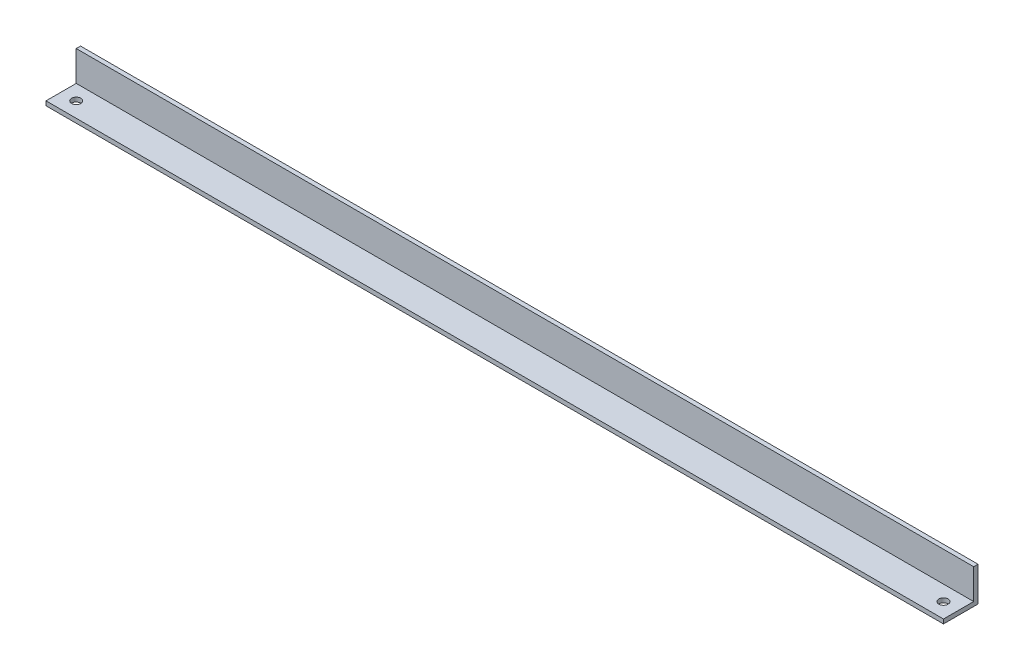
SolidWorks part; units mm, degrees
ref_plane "Front Plane" through (0, 0, 0) normal (0, 0, 1) x (1, 0, 0)
ref_plane "Top Plane" through (0, 0, 0) normal (0, 1, 0) x (1, 0, 0)
ref_plane "Right Plane" through (0, 0, 0) normal (1, 0, 0) x (0, 0, -1)
sketch "Sketch1" plane through (0, 0, 0) normal (0, 1, 0) x (1, 0, 0)
  line L1 (-330.2, 12.7) -> (330.2, 12.7)
  line L2 (-330.2, 12.7) -> (-330.2, -12.7)
  line L3 (-330.2, -12.7) -> (330.2, -12.7)
  line L4 (330.2, 12.7) -> (330.2, -12.7)
  line L5 (-330.2, 12.7) -> (330.2, -12.7) construction
  line L6 (-330.2, -12.7) -> (330.2, 12.7) construction
  point P0 (0, 0)
  dimension "D1" = 660.4
  dimension "D2" = 25.4
extrude "Boss-Extrude1" add sketch "Sketch1" along normal blind 3.175
sketch "Sketch2" plane through (0, 3.175, 0) normal (0, 1, 0) x (1, 0, 0)
  line L0 (-330.2, 12.7) -> (-330.2, 9.525)
  line L1 (-330.2, 12.7) -> (-330.2, -12.7) construction
  line L2 (-330.2, 9.525) -> (330.2, 9.525)
  line L3 (330.2, -12.7) -> (330.2, 12.7) construction
  line L4 (330.2, 9.525) -> (330.2, 12.7)
  line L5 (330.2, 12.7) -> (-330.2, 12.7)
  dimension "D1" = 3.175
extrude "Boss-Extrude2" add sketch "Sketch2" along normal blind 22.225
sketch "Sketch3" plane through (0, 3.175, 0) normal (0, 1, 0) x (1, 0, 0)
  line L0 (-330.2, -1.5875) -> (330.2, -1.5875) construction
  line L1 (-330.2, 9.525) -> (-330.2, -12.7) construction
  line L2 (330.2, -12.7) -> (330.2, 9.525) construction
  line L3 (-330.2, -12.7) -> (330.2, -12.7) construction
  circle A0 centre (-319.0875, -1.5875) radius 3.3782
  circle A2 centre (319.0875, -1.5875) radius 3.3782
  dimension "D3" = 6.7564
  dimension "D4" = 6.7564
  dimension "D1" = 11.1125
  dimension "D6" = 11.1125
  dimension "D8" = 11.1125
extrude "Cut-Extrude1" cut sketch "Sketch3" against normal through all
